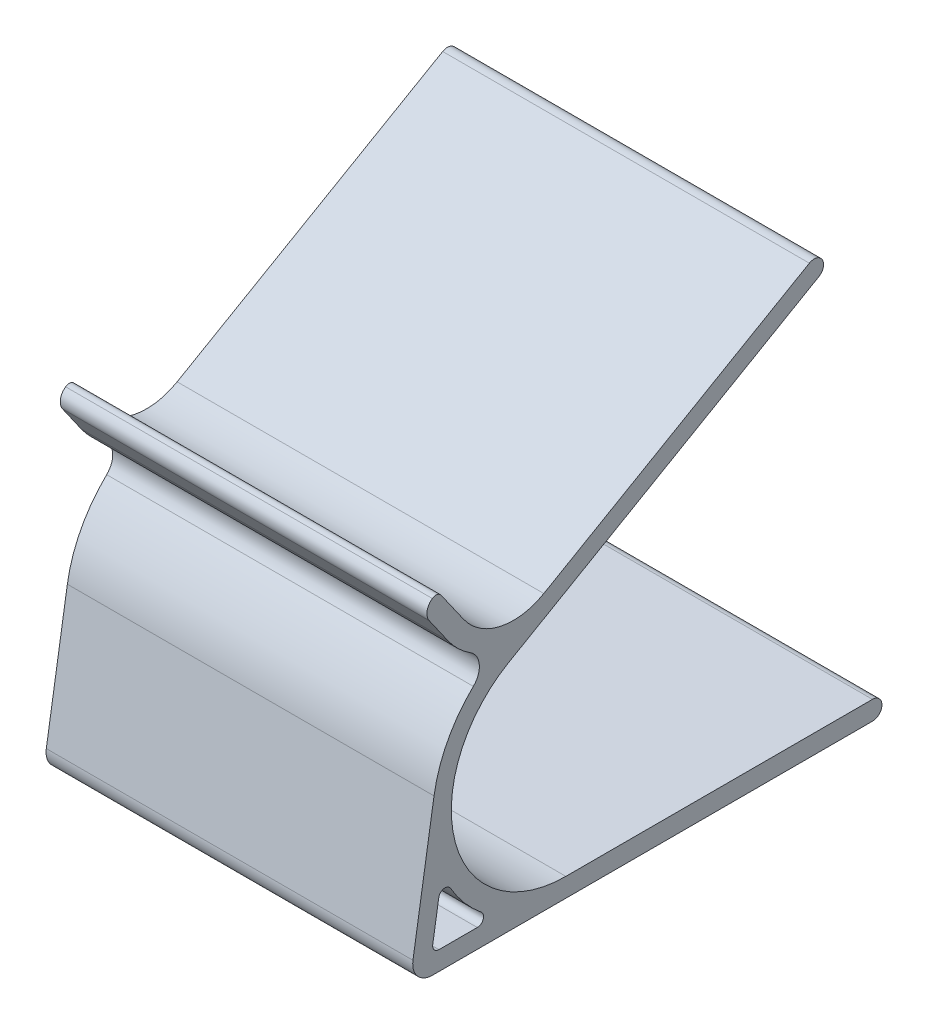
SolidWorks part; units mm, degrees
ref_plane "Front Plane" through (0, 0, 0) normal (0, 0, 1) x (1, 0, 0)
ref_plane "Top Plane" through (0, 0, 0) normal (0, 1, 0) x (1, 0, 0)
ref_plane "Right Plane" through (0, 0, 0) normal (1, 0, 0) x (0, 0, -1)
sketch "Sketch1" plane through (0, 0, 0) normal (1, 0, 0) x (0, 0, -1)
  line L0 (0, 0) -> (50, 0)
  line L1 (50, 0) -> (50, 3)
  line L2 (50, 3) -> (0, 3)
  line L4 (39.8169, 68.4898) -> (41.3169, 65.8917)
  line L5 (41.3169, 65.8917) -> (-9.0587, 36.8074)
  line L6 (39.8169, 68.4898) -> (-3.4844, 43.4898)
  line L9 (-16.1762, 46.3035) -> (-20.306, 52.2014)
  line L10 (-20.306, 52.2014) -> (-22.7634, 50.4807)
  line L11 (-22.7634, 50.4807) -> (-18.6337, 44.5828)
  line L12 (-10.5587, 39.4055) -> (-9.0587, 36.8074) construction
  line L13 (-24.1836, 3.5949) -> (-20.853, 24.4479)
  line L14 (-21.1173, 0) -> (0, 0)
  line L15 (-20.0996, 10.1439) -> (-21.0557, 4.1577)
  line L16 (-20.0682, 3) -> (-14.0062, 3)
  line L17 (-19.6017, 13.2614) -> (-17.8906, 23.9748) construction
  line L18 (-19.6017, 13.2614) -> (-20.0996, 10.1439) construction
  line L19 (-14.0062, 3) -> (-10.8491, 3) construction
  arc A0 (-20.853, 24.4479) -> (-14.6317, 36.3441) centre (0, 21.1173) cw
  arc A1 (0, 3) -> (-9.0587, 36.8074) centre (0, 21.1173) cw
  arc A2 (-3.4844, 43.4898) -> (-16.1762, 46.3035) centre (-8.295, 51.822) cw
  arc A3 (-18.6337, 44.5828) -> (-15.1072, 41.1971) centre (-8.295, 51.822) ccw
  arc A4 (-21.1173, 0) -> (-24.1836, 3.5949) centre (-21.1173, 3.1051) cw
  arc A5 (0, 0) -> (-10.8491, 3) centre (0, 21.1173) cw construction
  arc A6 (-15.1072, 41.1971) -> (-14.6317, 36.3441) centre (-16.7832, 38.5831) cw
  arc A7 (-15.1072, 41.1971) -> (-10.5587, 39.4055) centre (-8.295, 51.822) ccw construction
  arc A8 (-14.6317, 36.3441) -> (-10.5587, 39.4055) centre (0, 21.1173) cw construction
  arc A10 (-19.6017, 13.2614) -> (-20.853, 24.4479) centre (0, 21.1173) cw construction
  arc A11 (-18.248, 10.4894) -> (-13.3729, 4.7739) centre (0, 21.1173) ccw
  arc A12 (-20.0996, 10.1439) -> (-18.248, 10.4894) centre (-19.1121, 9.9861) cw
  arc A13 (-13.3729, 4.7739) -> (-14.0062, 3) centre (-14.0062, 4) cw
  arc A14 (-21.0557, 4.1577) -> (-20.0682, 3) centre (-20.0682, 4) ccw
  arc A15 (-19.6017, 13.2614) -> (-18.248, 10.4894) centre (0, 21.1173) ccw construction
  arc A16 (-13.3729, 4.7739) -> (-10.8491, 3) centre (0, 21.1173) ccw construction
  point P7 (-21.1173, 21.1173)
  dimension "D4" = 13
  dimension "D8" = 1
  dimension "D1" = 7.2
  dimension "D2" = 50
  dimension "D3" = 3
  dimension "D5" = 95
  dimension "D6" = 35
  dimension "D7" = 30
extrude "Boss-Extrude1" add sketch "Sketch1" along normal blind 58
fillet "Fillet1" radius 2 1 edges at (29, 50.4807, 22.7634)
fillet "Fillet2" radius 1 1 edges at (29, 52.2014, 20.306)
fillet "Fillet3" radius 1.5 4 edges at (29, 3, -50) (29, 0, -50) (29, 65.8917, -41.3169) (29, 68.4898, -39.8169)
